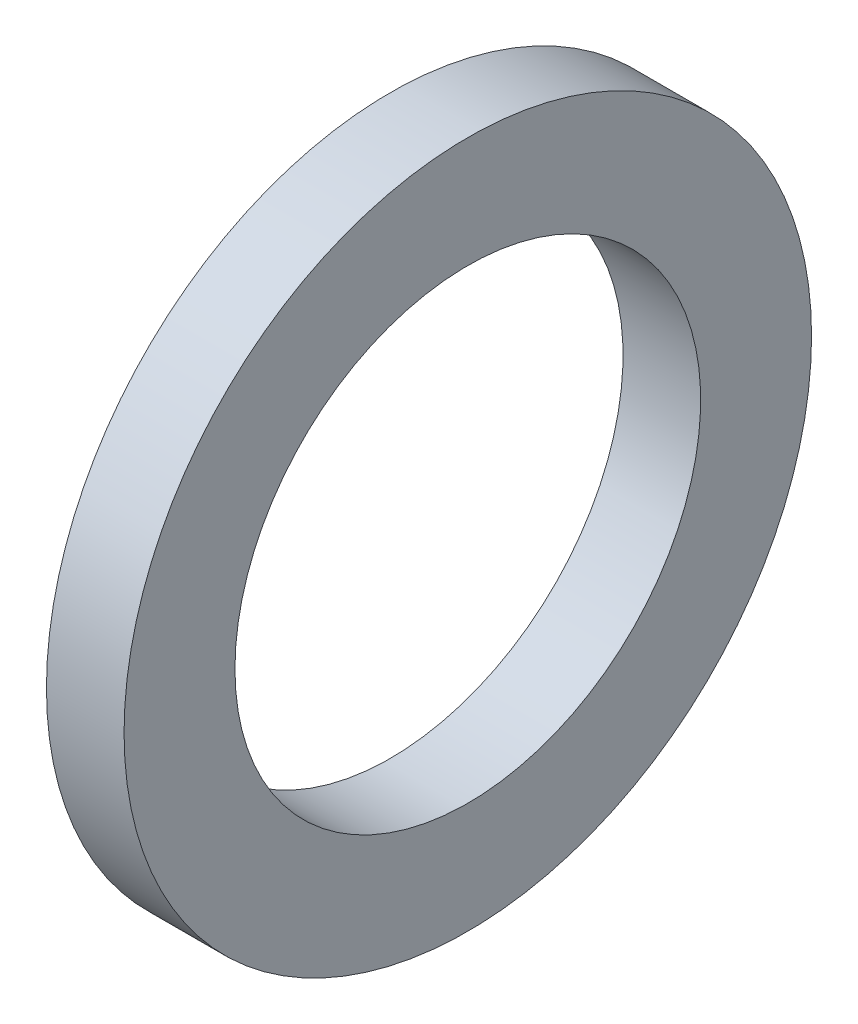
SolidWorks part; units mm, degrees
ref_plane "Plane1" through (0, 0, 0) normal (0, 0, 1) x (1, 0, 0)
ref_plane "Plane2" through (0, 0, 0) normal (0, 1, 0) x (1, 0, 0)
ref_plane "Plane3" through (0, 0, 0) normal (1, 0, 0) x (0, 0, -1)
other "Configuration Table"
sketch "Sketch1" plane through (0, 0, 0) normal (0, 0, 1) x (1, 0, 0)
  line L0 (-34.925, 0) -> (9.525, 0) construction
  line L1 (0, 10.5) -> (0, 15.5)
  line L2 (0, 15.5) -> (-3.5, 15.5)
  line L3 (-3.5, 15.5) -> (-3.5, 10.5)
  line L4 (-3.5, 10.5) -> (0, 10.5)
  dimension "Thickness" = 3.5
  dimension "Inside_dia" = 21
  dimension "Outside_dia" = 31
revolve "Base-Revolve" add sketch "Sketch1" angle 360 about L0
